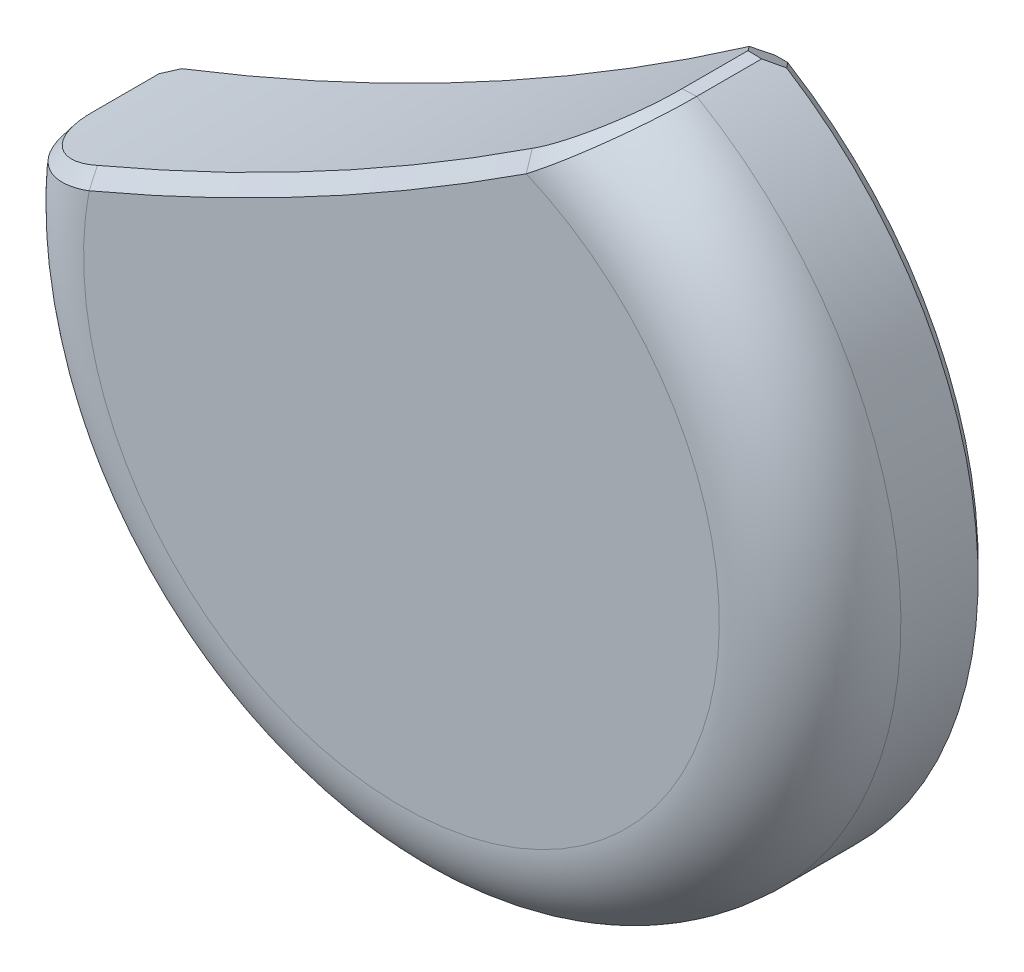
SolidWorks part; units mm, degrees
ref_plane "Спереди" through (0, 0, 0) normal (0, 0, 1) x (1, 0, 0)
ref_plane "Сверху" through (0, 0, 0) normal (0, 1, 0) x (1, 0, 0)
ref_plane "Справа" through (0, 0, 0) normal (1, 0, 0) x (0, 0, -1)
sketch "Эскиз1" plane through (0, 0, 0) normal (0, 0, 1) x (1, 0, 0)
  circle A0 centre (0, 0) radius 4.5
  dimension "D1" = 9
extrude "Бобышка-Вытянуть1" add sketch "Эскиз1" along normal blind 2
fillet "Скругление1" radius 1 1 edges at (4.5, 0, 2)
chamfer "Фаска1" distance 0.15 angle 45 1 edges at (4.5, 0, 0)
sketch "Эскиз2" plane through (0, 0, 0) normal (0, 0, 1) x (1, 0, 0)
  line L0 (0, 4.5) -> (0, 0) construction
  line L1 (0, 0) -> (-2.1196, 3.9696) construction
  line L2 (-6.0025, -0.6884) -> (3.7981, 4.5447) construction
  circle A0 centre (-15.176, 28.4221) radius 30
  circle A1 centre (0, 0) radius 4.5 construction
  dimension "D1" = 60
  dimension "D2" = 28.1
  dimension "D3" = 2.22
extrude "Вырез-Вытянуть2" cut sketch "Эскиз2" along normal blind 2
chamfer "Фаска2" distance 0.15 angle 45 8 edges at (-1.0456, 1.9583, 0) (2.1676, 3.9436, 0.575) (-4.4828, 0.3926, 0.575) (2.0019, 3.827, 1.5737) (-4.1805, 0.5098, 1.7027) (-1.0456, 1.9583, 2)
